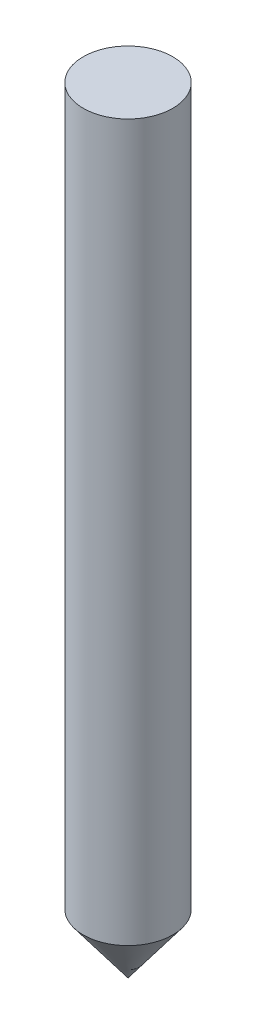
SolidWorks part; units mm, degrees
ref_plane "Alzado" through (0, 0, 0) normal (0, 0, 1) x (1, 0, 0)
ref_plane "Planta" through (0, 0, 0) normal (0, 1, 0) x (1, 0, 0)
ref_plane "Vista lateral" through (0, 0, 0) normal (1, 0, 0) x (0, 0, -1)
sketch "Croquis1" plane through (0, 0, 0) normal (0, 0, 1) x (1, 0, 0)
  line L0 (0, 0) -> (0, 130) construction
  line L1 (0, 130) -> (-7.5, 130)
  line L2 (-7.5, 130) -> (-7.5, 10)
  line L3 (-7.5, 10) -> (0, 0)
  line L4 (0, 0) -> (0, 130)
  dimension "D1" = 15
  dimension "D2" = 120
  dimension "D3" = 10
revolve "Revolución1" add sketch "Croquis1" angle 360 about L0
